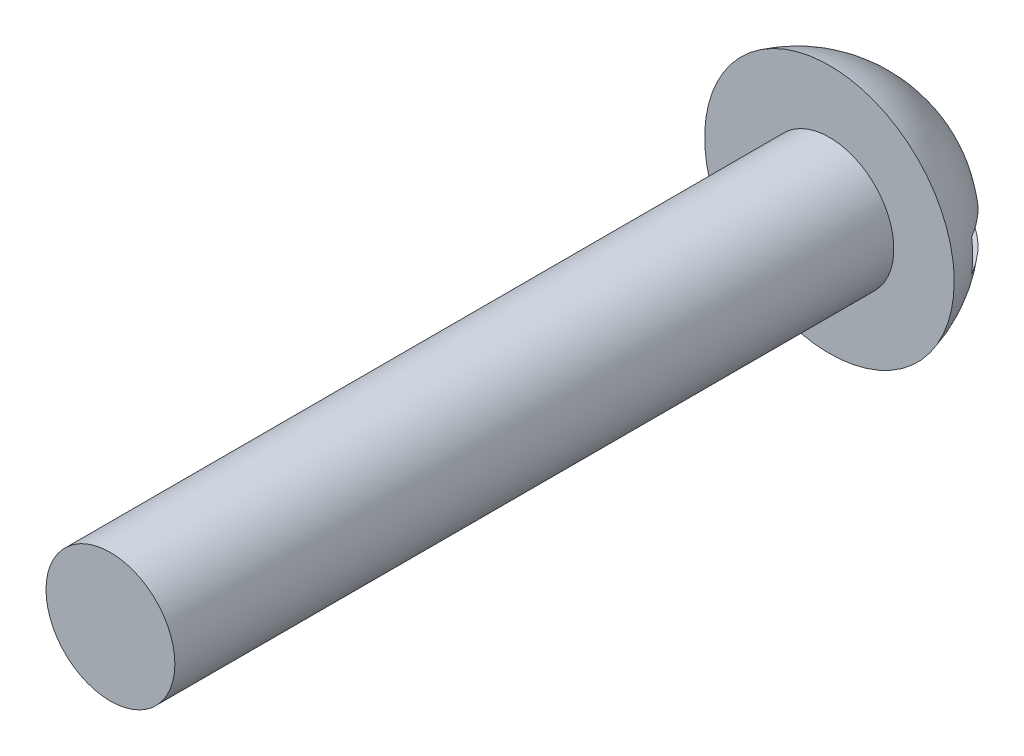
SolidWorks part; units mm, degrees
ref_plane "Plane1" through (0, 0, 0) normal (0, 0, 1) x (1, 0, 0)
ref_plane "Plane2" through (0, 0, 0) normal (0, 1, 0) x (1, 0, 0)
ref_plane "Plane3" through (0, 0, 0) normal (1, 0, 0) x (0, 0, -1)
sketch "Sketch1" plane through (0, 0, 0) normal (1, 0, 0) x (0, 0, -1)
  line L0 (-22.86, 15.2822) -> (-20.7264, 15.2822)
  line L1 (-28.5941, 15.2822) -> (6.9659, 15.2822) construction
  line L2 (-22.86, 18.0366) -> (-22.86, 15.2822)
  arc A0 (-20.7264, 15.2822) -> (-22.86, 18.0366) centre (-23.5712, 15.2822) ccw
  dimension "D2" = 2.8448
  dimension "D1" = 2.1336
revolve "Base-Revolve" add sketch "Sketch1" angle 360 about L1
sketch "Sketch2" plane through (0, 0, 22.86) normal (0, 0, 1) x (1, 0, 0)
  circle A0 centre (0, 15.24) radius 1.4224
  dimension "D1" = 2.8448
extrude "Boss-Extrude1" add sketch "Sketch2" along normal blind 15.875
sketch "Sketch4" plane through (0, 0, 0) normal (1, 0, 0) x (0, 0, -1)
  line L2 (-22.1711, 14.9266) -> (-20.7487, 14.9266)
  line L3 (-22.1711, 15.6378) -> (-20.7487, 15.6378)
  line L4 (-22.1711, 15.6378) -> (-22.1711, 14.9266)
  arc A1 (-22.86, 12.5277) -> (-22.86, 18.0366) centre (-23.5712, 15.2822) ccw construction
  arc A2 (-20.7487, 14.9266) -> (-20.7487, 15.6378) centre (-23.5712, 15.2822) ccw
  dimension "D1" = 1.4224
  dimension "D2" = 0.7112
  dimension "D3" = 0.3556
extrude "Cut-Extrude1" cut sketch "Sketch4" against normal through all
mirror "Mirror1" about plane through (0, 15.2822, 23.5712) normal (1, 0, 0) of "Cut-Extrude1"
equation "\"D1@Sketch1\"=(3/4)*\"D1@Sketch2\""
equation "\"D2@Sketch1\"=\"D1@Sketch2\""
equation "\"D1@Sketch4\"=.5*\"D1@Sketch2\""
equation "\"D2@Sketch4\"=.25*\"D1@Sketch2\""
equation "\"D3@Sketch4\"=(1/8)*\"D1@Sketch2\""
